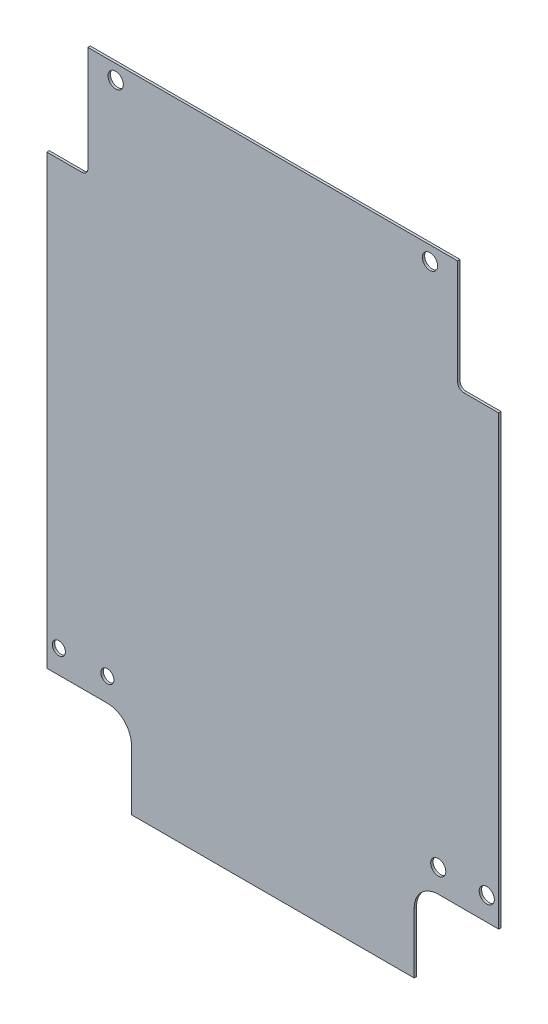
SolidWorks part; units mm, degrees
ref_plane "Front Plane" through (0, 0, 0) normal (0, 0, 1) x (1, 0, 0)
ref_plane "Top Plane" through (0, 0, 0) normal (0, 1, 0) x (1, 0, 0)
ref_plane "Right Plane" through (0, 0, 0) normal (1, 0, 0) x (0, 0, -1)
sketch "Sketch1" plane through (0, 0, 0) normal (0, 0, 1) x (1, 0, 0)
  line L12 (76.482, -17.46) -> (76.482, 26)
  line L13 (76.482, 26) -> (-76.5, 26)
  line L14 (-76.5, 26) -> (-76.5, -17.46)
  line L15 (-79.04, -20) -> (-93.5, -20)
  line L16 (-93.5, -20) -> (-93.5, -205)
  line L17 (-93.5, -205) -> (-68.5, -205)
  line L18 (-58.5, -215) -> (-58.5, -240)
  line L19 (-58.5, -240) -> (58.5, -240)
  line L20 (58.5, -240) -> (58.5, -215)
  line L21 (68.5, -205) -> (93.5, -205)
  line L22 (93.5, -205) -> (93.5, -20)
  line L23 (93.5, -20) -> (79.022, -20)
  line L24 (76.482, -17.46) -> (76.482, 26)
  line L25 (76.482, 26) -> (-76.5, 26)
  line L26 (-76.5, 26) -> (-76.5, -17.46)
  line L27 (-79.04, -20) -> (-93.5, -20)
  line L28 (-93.5, -20) -> (-93.5, -205)
  line L29 (-93.5, -205) -> (-68.5, -205)
  line L30 (-58.5, -215) -> (-58.5, -240)
  line L31 (-58.5, -240) -> (58.5, -240)
  line L32 (58.5, -240) -> (58.5, -215)
  line L33 (68.5, -205) -> (93.5, -205)
  line L34 (93.5, -205) -> (93.5, -20)
  line L35 (93.5, -20) -> (79.022, -20)
  arc A4 (-79.04, -20) -> (-76.5, -17.46) centre (-79.04, -17.46) ccw
  arc A5 (-58.5, -215) -> (-68.5, -205) centre (-68.5, -215) ccw
  arc A6 (68.5, -205) -> (58.5, -215) centre (68.5, -215) ccw
  arc A7 (76.482, -17.46) -> (79.022, -20) centre (79.022, -17.46) ccw
  arc A8 (-79.04, -20) -> (-76.5, -17.46) centre (-79.04, -17.46) ccw
  arc A9 (-58.5, -215) -> (-68.5, -205) centre (-68.5, -215) ccw
  arc A10 (68.5, -205) -> (58.5, -215) centre (68.5, -215) ccw
  arc A11 (76.482, -17.46) -> (79.022, -20) centre (79.022, -17.46) ccw
  circle A12 centre (-88.5373, -195.3352) radius 2.7 construction
  circle A13 centre (-68.4622, -195.3352) radius 2.7 construction
  circle A14 centre (-65.0266, 20.02) radius 3.175 construction
  circle A15 centre (65.0266, 20.02) radius 3.175 construction
  circle A16 centre (88.5373, -195.3352) radius 3.125 construction
  circle A17 centre (68.4622, -195.3352) radius 3.125 construction
  circle A18 centre (-88.5373, -195.3352) radius 2.7
  circle A19 centre (-68.4622, -195.3352) radius 2.7
  circle A20 centre (-65.0266, 20.02) radius 3.175
  circle A21 centre (65.0266, 20.02) radius 3.175
  circle A22 centre (88.5373, -195.3352) radius 3.125
  circle A23 centre (68.4622, -195.3352) radius 3.125
  dimension "D1" = 0
extrude "Extrude1" add sketch "Sketch1" along normal blind 1
